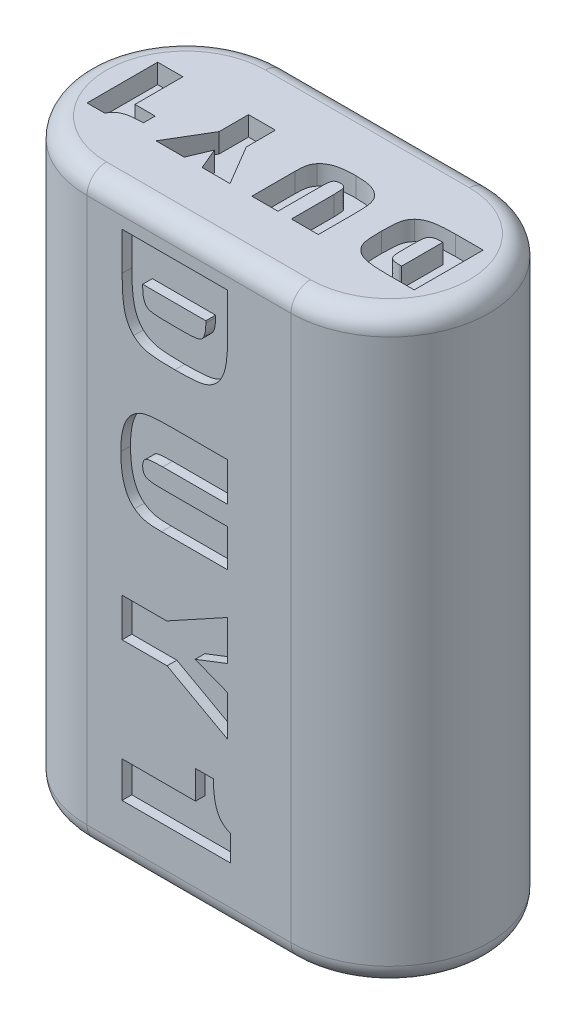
SolidWorks part; units mm, degrees
ref_plane "Front Plane" through (0, 0, 0) normal (0, 0, 1) x (1, 0, 0)
ref_plane "Top Plane" through (0, 0, 0) normal (0, 1, 0) x (1, 0, 0)
ref_plane "Right Plane" through (0, 0, 0) normal (1, 0, 0) x (0, 0, -1)
sketch3d "3DSketch1" plane through (0, 0, 0) normal (0, 0, 1) x (1, 0, 0)
sketch "Main Outline" plane through (0, 0, 0) normal (0, 1, 0) x (1, 0, 0)
  line L6 (15.2562, 6.5669) -> (4.7777, 6.5669) construction
  line L7 (15.2562, 1.4809) -> (4.7777, 1.4809)
  line L8 (15.2562, 11.6529) -> (4.7777, 11.6529)
  arc A0 (15.2562, 1.4809) -> (15.2562, 11.6529) centre (15.2562, 6.5669) ccw
  arc A1 (4.7777, 11.6529) -> (4.7777, 1.4809) centre (4.7777, 6.5669) ccw
  point P5 (10.0169, 6.5669)
sketch "USB Hole" plane through (0, 0, 0) normal (0, -1, 0) x (-1, 0, 0)
  line L5 (-17.4253, 9.8333) -> (-2.6086, 9.8333)
  line L6 (-17.4253, 9.8333) -> (-17.4253, 3.3005)
  line L7 (-17.4253, 3.3005) -> (-2.6086, 3.3005)
  line L8 (-2.6086, 9.8333) -> (-2.6086, 3.3005)
extrude "Boss-Extrude1" add sketch "Main Outline" along normal blind 30
extrude "Cut-Extrude1" cut sketch "USB Hole" against normal blind 5
fillet "Round the bottom" radius 1 4 edges at (-0.3083, 30, -6.5669) (10.0169, 30, -11.6529) (20.3422, 30, -6.5669) (10.0169, 30, -1.4809)
sketch "Bottom Text Line" plane through (0, 30, 0) normal (0, 1, 0) x (1, 0, 0)
  line L0 (19.3422, 8.2327) -> (0.6917, 8.2327)
sketch "Bottom Text" plane through (0, 30, 0) normal (0, 1, 0) x (1, 0, 0)
  text T0 "<b>DUY1</b>" font "Swis721 BlkCn BT" height 3.5
extrude "Bottom Text Cut" cut sketch "Bottom Text" against normal blind 1
sketch "Side 1 Text Line" plane through (0, 0, -1.4809) normal (0, 0, 1) x (1, 0, 0)
  line L0 (6.5793, 29) -> (6.5793, 1.1736)
sketch "Side 1 Text" plane through (0, 0, -1.4809) normal (0, 0, 1) x (1, 0, 0)
  text T0 "<b>DUY1</b>" font "Swis721 BlkCn BT" height in points 20
extrude "Cut Text 1" cut sketch "Side 1 Text" against normal blind 0.5
sketch "Side 2 Text Line" plane through (0, 0, -11.6529) normal (0, 0, -1) x (-1, 0, 0)
  line L0 (-6.5793, 1.1736) -> (-6.5793, 29)
sketch "Side 2 Text" plane through (0, 0, -11.6529) normal (0, 0, -1) x (-1, 0, 0)
  text T0 "<b>DUY1</b>" font "Swis721 BlkCn BT" height in points 20
extrude "Cut Text 2" cut sketch "Side 2 Text" against normal blind 0.5
fillet "Round the top" radius 1 4 edges at (10.0169, 0, -11.6529) (20.3422, 0, -6.5669) (10.0169, 0, -1.4809) (-0.3083, 0, -6.5669)
sketch "Magnet Profile" plane through (0, 5, 0) normal (0, -1, 0) x (1, 0, 0)
  line L1 (5.054, -3.9993) -> (14.8819, -3.9993)
  line L2 (5.054, -3.9993) -> (5.054, -9.1105)
  line L3 (5.054, -9.1105) -> (14.8819, -9.1105)
  line L4 (14.8819, -3.9993) -> (14.8819, -9.1105)
  line L5 (5.054, -3.9993) -> (14.8819, -9.1105) construction
  line L6 (5.054, -9.1105) -> (14.8819, -3.9993) construction
  point P0 (9.9679, -6.5549)
extrude "Cut magnet hole" cut sketch "Magnet Profile" against normal blind 19.5
